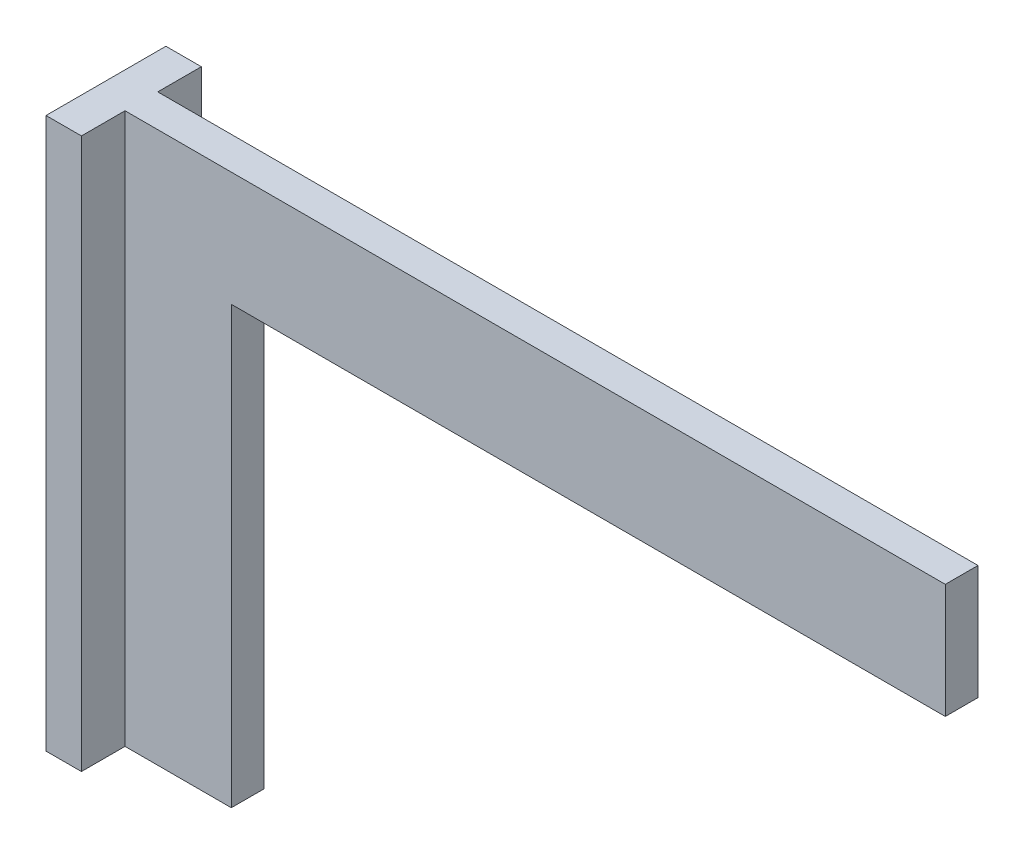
SolidWorks part; units mm, degrees
ref_plane "Plan de face" through (0, 0, 0) normal (0, 0, 1) x (1, 0, 0)
ref_plane "Plan de dessus" through (0, 0, 0) normal (0, 1, 0) x (1, 0, 0)
ref_plane "Plan de droite" through (0, 0, 0) normal (1, 0, 0) x (0, 0, -1)
sketch "Esquisse1" plane through (0, 0, 0) normal (0, 0, 1) x (1, 0, 0)
  line L0 (0, 0) -> (0, 101)
  line L1 (0, 101) -> (157, 101)
  line L2 (157, 101) -> (157, 80)
  line L3 (157, 80) -> (26, 80)
  line L4 (26, 80) -> (26, 0)
  line L5 (26, 0) -> (0, 0)
  dimension "D1" = 157
  dimension "D2" = 21
  dimension "D3" = 101
  dimension "D4" = 26
extrude "Boss.-Extru.1" add sketch "Esquisse1" along normal blind 6
sketch "Esquisse2" plane through (0, 0, 6) normal (0, 0, 1) x (1, 0, 0)
  line L0 (0, 0) -> (26, 0) construction
  line L1 (0, 101) -> (6.5, 101)
  line L2 (0, 101) -> (0, 0)
  line L3 (0, 0) -> (6.5, 0)
  line L4 (6.5, 101) -> (6.5, 0)
  dimension "D1" = 6.5
extrude "Boss.-Extru.2" add sketch "Esquisse2" along normal blind 8 and the other way blind 14
